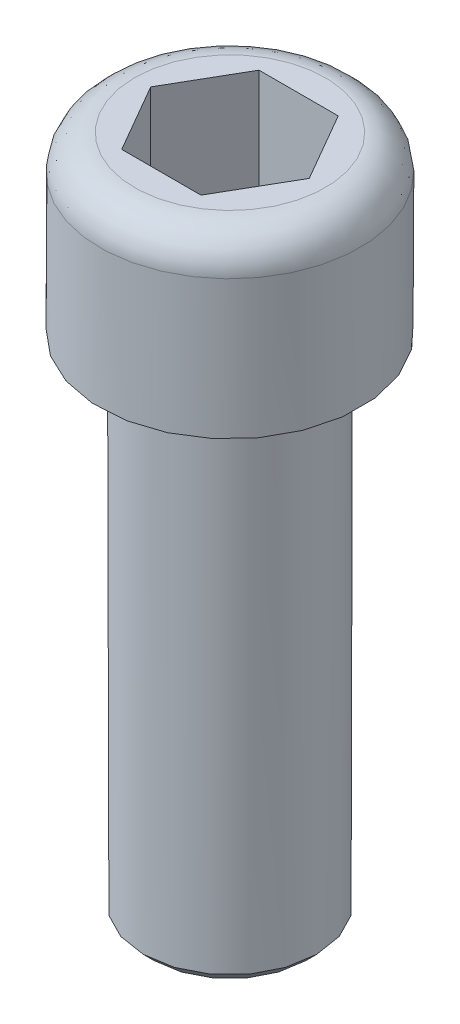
SolidWorks part; units mm, degrees
ref_plane "Plan1" through (0, 0, 0) normal (0, 0, 1) x (1, 0, 0)
ref_plane "Plan2" through (0, 0, 0) normal (0, 1, 0) x (1, 0, 0)
ref_plane "Plan3" through (0, 0, 0) normal (1, 0, 0) x (0, 0, -1)
sketch "Esquisse1" plane through (0, 0, 0) normal (0, 0, 1) x (1, 0, 0)
  line L0 (0, 6) -> (0, -50) construction
  line L1 (0, 6) -> (3.8, 6)
  line L2 (5, 4.8) -> (5, 0)
  line L3 (5, 0) -> (3.3, 0)
  line L4 (3, -0.3) -> (3, -49.5)
  line L5 (2.5, -50) -> (0, -50)
  line L6 (3, -49.5) -> (2.5, -50)
  line L7 (0, -50) -> (0, 6)
  arc A0 (3.8, 6) -> (5, 4.8) centre (3.8, 4.8) cw
  arc A1 (3.3, 0) -> (3, -0.3) centre (3.3, -0.3) ccw
  point P12 (3, -50)
  dimension "C2" = 0.3
  dimension "C1" = 1.2
  dimension "D1" = 10
  dimension "R" = 0.5
  dimension "D2" = 45
  dimension "L1" = 50
  dimension "H" = 6
  dimension "D" = 6
revolve "Révolution1" add sketch "Esquisse1" angle 360 about L0
sketch "Esquisse2" plane through (0, 6, 0) normal (0, 1, 0) x (1, 0, 0)
  line L1 (2.8868, 0) -> (1.4434, 2.5)
  line L2 (1.4434, 2.5) -> (-1.4434, 2.5)
  line L3 (-1.4434, 2.5) -> (-2.8868, 0)
  line L4 (-2.8868, 0) -> (-1.4434, -2.5)
  line L5 (-1.4434, -2.5) -> (1.4434, -2.5)
  line L6 (1.4434, -2.5) -> (2.8868, 0)
  circle A0 centre (0, 0) radius 2.5 construction
  dimension "S" = 5
extrude "Enlèv. mat.-Extru.1" cut sketch "Esquisse2" against normal blind 3.75
equation "\"C1@Esquisse1\" = \"D@Esquisse1\"/5"
equation "\"Prof@Enlèv. mat.-Extru.1\" = \"D@Esquisse1\"*0.625"
equation "\"H@Esquisse1\" = \"D@Esquisse1\""
equation "\"C2@Esquisse1\"=\"D@Esquisse1\"/20"
equation "\"R@Esquisse1\"=(\"D@Esquisse1\"-\"D2@Représentation de filetage1\")/2"
